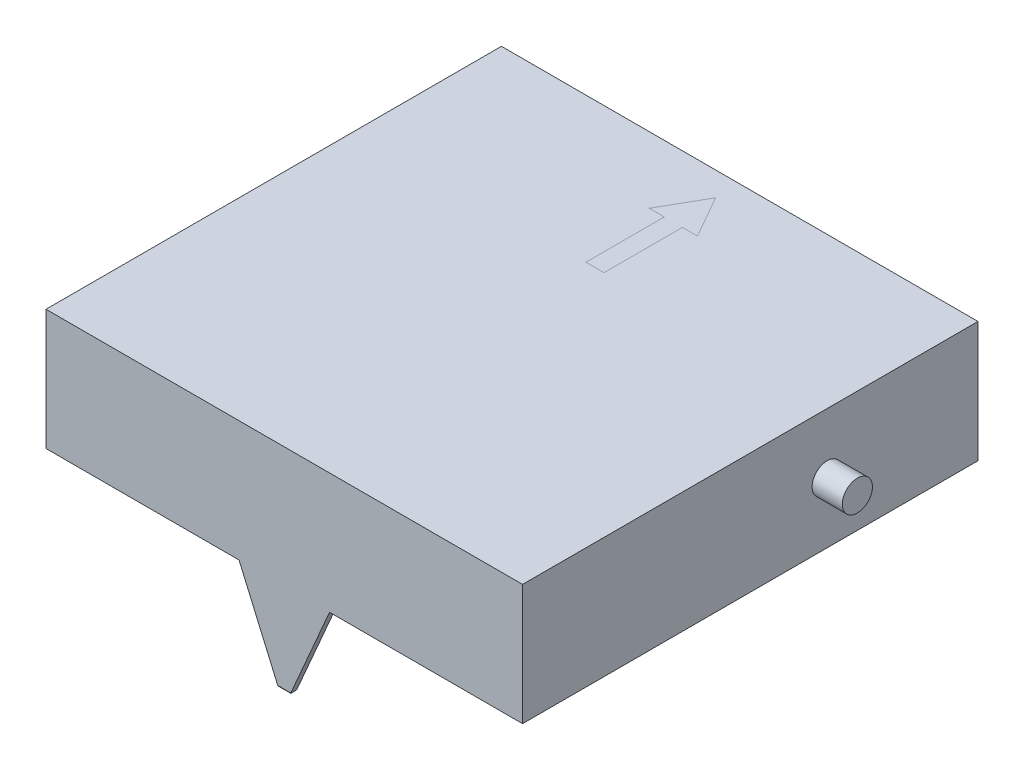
SolidWorks part; units mm, degrees
ref_plane "Front Plane" through (0, 0, 0) normal (0, 0, 1) x (1, 0, 0)
ref_plane "Top Plane" through (0, 0, 0) normal (0, 1, 0) x (1, 0, 0)
ref_plane "Right Plane" through (0, 0, 0) normal (1, 0, 0) x (0, 0, -1)
sketch "Sketch1" plane through (0, 0, 0) normal (0, 1, 0) x (1, 0, 0)
  line L1 (0, 0) -> (79, 0)
  line L2 (0, 0) -> (0, 75.5)
  line L3 (0, 75.5) -> (79, 75.5)
  line L4 (79, 0) -> (79, 75.5)
  dimension "D1" = 75.5
  dimension "D2" = 79
extrude "Boss-Extrude1" add sketch "Sketch1" along normal blind 20
sketch "Sketch2" plane through (0, 0, 0) normal (0, 0, 1) x (1, 0, 0)
  line L0 (32, 0) -> (38.5, -15)
  line L1 (0, 0) -> (79, 0) construction
  line L2 (38.5, -15) -> (40.5, -15)
  line L3 (40.5, -15) -> (47, 0)
  line L4 (32, 0) -> (47, 0)
  point P7 (39.5, -15)
  point P8 (39.5, 0)
  dimension "D1" = 15
  dimension "D2" = 15
  dimension "D3" = 2
extrude "Boss-Extrude2" add sketch "Sketch2" against normal blind 1
sketch "Sketch3" plane through (79, 0, 0) normal (1, 0, 0) x (0, 0, -1)
  line L0 (75.5, 20) -> (75.5, 0) construction
  circle A0 centre (50.5, 10) radius 2.5
  point P5 (75.5, 10)
  dimension "D1" = 5
  dimension "D2" = 25
extrude "Boss-Extrude3" add sketch "Sketch3" along normal blind 5 and the other way offset from surface (84 mm away) 5
sketch "Sketch4" plane through (0, 20, 0) normal (0, 1, 0) x (1, 0, 0)
  line L0 (79, 75.5) -> (0, 75.5) construction
  point P0 (39.5, 50.5)
  point P4 (39.5, 75.5)
  dimension "D1" = 25
sketch "Sketch5" plane through (0, 20, 0) normal (0, 1, 0) x (1, 0, 0)
  line L0 (38, 51.5) -> (38, 64.5)
  line L1 (38, 64.5) -> (35.5, 64.5)
  line L2 (35.5, 64.5) -> (39.5, 71.5)
  line L3 (39.5, 71.5) -> (43.5, 64.5)
  line L4 (43.5, 64.5) -> (41, 64.5)
  line L5 (41, 64.5) -> (41, 51.5)
  line L6 (41, 51.5) -> (38, 51.5)
  line L7 (79, 75.5) -> (0, 75.5) construction
  point P2 (39.5, 51.5)
  dimension "D1" = 3
  dimension "D2" = 8
  dimension "D3" = 20
  dimension "D4" = 4
  dimension "D5" = 7
shell "Shell1" [suppressed] thickness 2
fillet "Fillet1" radius 0.25 4 edges at (40.5, -15, -0.5) (39.5, -15, -1) (38.5, -15, -0.5) (39.5, -15, 0)
